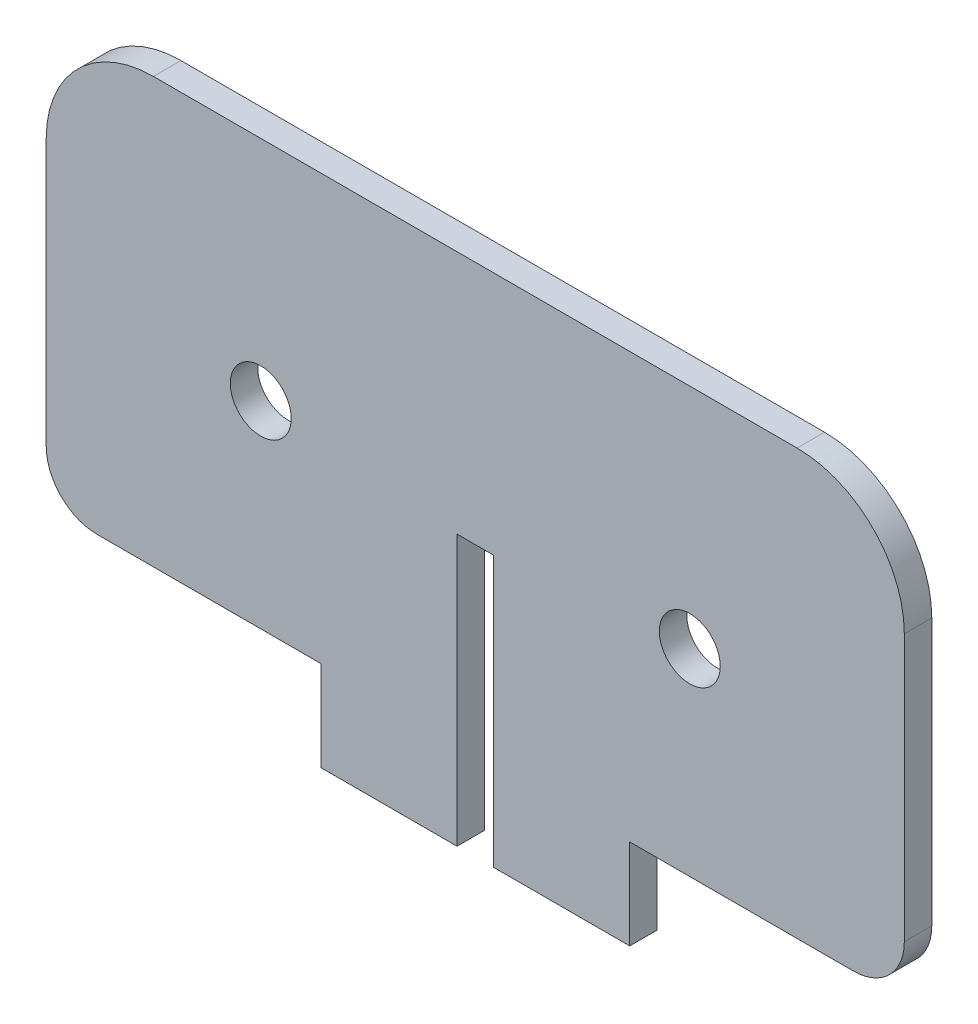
SolidWorks part; units mm, degrees
ref_plane "Front Plane" through (0, 0, 0) normal (0, 0, 1) x (1, 0, 0)
ref_plane "Top Plane" through (0, 0, 0) normal (0, 1, 0) x (1, 0, 0)
ref_plane "Right Plane" through (0, 0, 0) normal (1, 0, 0) x (0, 0, -1)
sketch "Sketch1" plane through (0, 0, 0) normal (0, 0, 1) x (1, 0, 0)
  line L0 (0, 28.8473) -> (0, 91)
  line L1 (25, 116) -> (175, 116)
  line L2 (200, 91) -> (200, 28.8473)
  line L3 (188.1527, 17) -> (136, 17)
  line L4 (100, 59) -> (100, -47.1783) construction
  line L8 (136, 17) -> (136, -4)
  line L9 (136, -4) -> (104.25, -4)
  line L10 (104.25, -4) -> (104.25, 59)
  line L11 (104.25, 59) -> (95.75, 59)
  line L12 (95.75, 59) -> (95.75, -4)
  line L13 (95.75, -4) -> (64, -4)
  line L14 (64, -4) -> (64, 17)
  line L19 (64, 17) -> (11.8473, 17)
  arc A0 (25, 116) -> (0, 91) centre (25, 91) ccw
  arc A1 (200, 91) -> (175, 116) centre (175, 91) ccw
  circle A2 centre (50, 63) radius 7.1
  circle A3 centre (150, 63) radius 7.1
  arc A4 (0, 28.8473) -> (11.8473, 17) centre (11.8473, 28.8473) ccw
  arc A5 (200, 28.8473) -> (188.1527, 17) centre (188.1527, 28.8473) cw
  dimension "D2" = 11.8473
  dimension "D3" = 11.8473
  dimension "D1" = 8.5
  dimension "D4" = 63
  dimension "D5" = 21
  dimension "D6" = 200
sheet metal parameters "Sheet-Metal1" thickness 6.4 parameters "D1"=0.7366
base flange "Base-Flange1" sketch "Sketch1" thickness 6.4 reverse thickness direction no parameters "D1"=0.7366
flat pattern "Flat-Pattern1"
sketch "Bend-Lines1" plane through (0, 0, 0) normal (0, 1, 0) x (-1, 0, 0)
